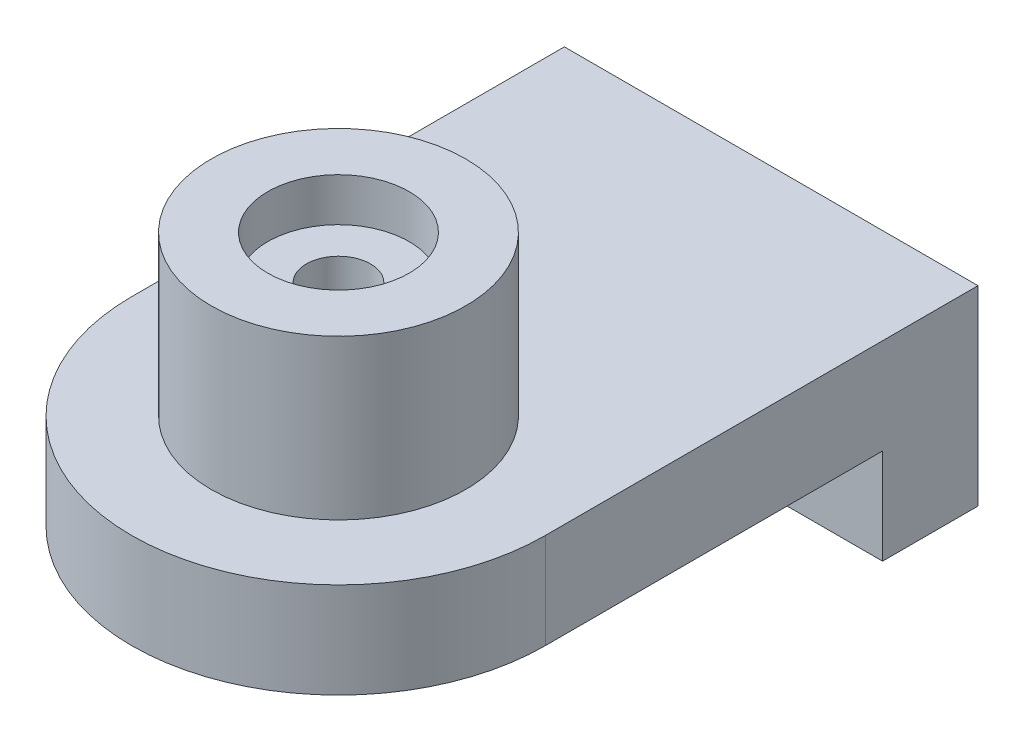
SolidWorks part; units mm, degrees
ref_plane "Front Plane" through (0, 0, 0) normal (0, 0, 1) x (1, 0, 0)
ref_plane "Top Plane" through (0, 0, 0) normal (0, 1, 0) x (1, 0, 0)
ref_plane "Right Plane" through (0, 0, 0) normal (1, 0, 0) x (0, 0, -1)
sketch "Sketch1" plane through (0, 0, 0) normal (0, 1, 0) x (1, 0, 0)
  line L0 (-32.5, 0) -> (-32.5, 68)
  line L1 (-32.5, 68) -> (32.5, 68)
  line L2 (32.5, 68) -> (32.5, 0)
  arc A0 (32.5, 0) -> (-32.5, 0) centre (0, 0) cw
  dimension "D1" = 65
  dimension "D2" = 68
extrude "Extrude1" add sketch "Sketch1" along normal blind 15
sketch "Sketch2" plane through (0, 0, 0) normal (0, -1, 0) x (1, 0, 0)
  line L0 (32.5, 0) -> (32.5, -68) construction
  line L1 (-32.5, -68) -> (32.5, -68)
  line L2 (-32.5, -68) -> (-32.5, -53)
  line L3 (-32.5, -53) -> (32.5, -53)
  line L4 (32.5, -68) -> (32.5, -53)
  dimension "D1" = 15
extrude "Extrude2" add sketch "Sketch2" along normal blind 15
sketch "Sketch3" plane through (0, 15, 0) normal (0, 1, 0) x (-1, 0, 0)
  circle A0 centre (0, 0) radius 20
  dimension "D1" = 40
extrude "Extrude3" add sketch "Sketch3" along normal blind 25
hole_wizard "CBORE for 3/8 Hex Head Bolt1" positions "Sketch5" profile "Sketch4" counterbore size "3/8" standard "Ansi Inch"
sketch "Sketch5" plane through (0, 40, 0) normal (0, 1, 0) x (-1, 0, 0)
  point P0 (0, 0)
sketch "Sketch4" plane through (0, 40, 0) normal (1, 0, 0) x (0, 0, 1)
  line L0 (0, 0) -> (0, 55)
  line L1 (0, 55) -> (5.0419, 55)
  line L3 (5.0419, 55) -> (5.0419, 6.8072)
  line L4 (5.0419, 6.8072) -> (11.1125, 6.8072)
  line L5 (11.1125, 6.8072) -> (11.1125, 0)
  line L7 (11.1125, 0) -> (0, 0)
  line L11 (0, -6.35) -> (0, 107.95) construction
  dimension "Thru Hole Dia." = 10.0838
  dimension "Thru Hole Depth" = 55
  dimension "C'Bore Dia." = 22.225
  dimension "C'Bore Depth" = 6.8072
